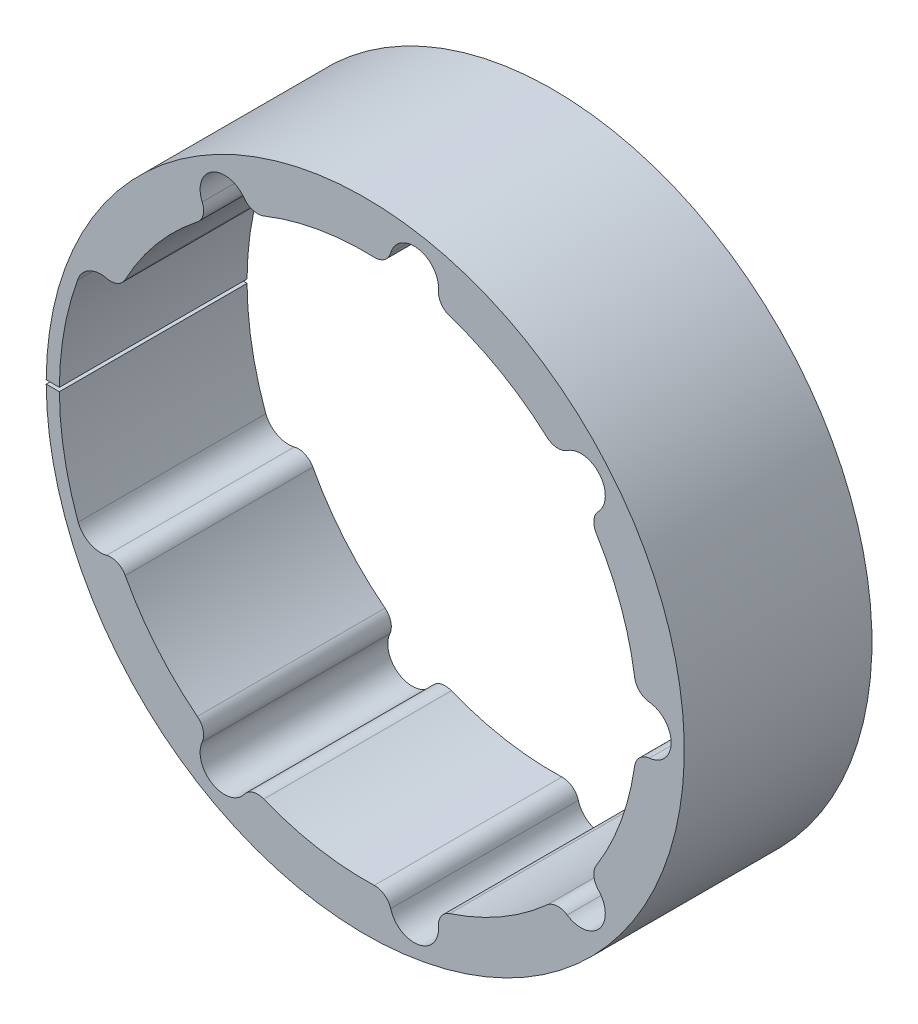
SolidWorks part; units mm, degrees
ref_plane "Front Plane" through (0, 0, 0) normal (0, 0, 1) x (1, 0, 0)
ref_plane "Top Plane" through (0, 0, 0) normal (0, 1, 0) x (1, 0, 0)
ref_plane "Right Plane" through (0, 0, 0) normal (1, 0, 0) x (0, 0, -1)
sketch "Sketch1" plane through (0, 0, 0) normal (0, 0, 1) x (1, 0, 0)
  line L0 (37.5, 3.25) -> (36.104, 3.25)
  line L1 (37.5, -3.25) -> (36.104, -3.25)
  line L2 (30.8157, -21.6149) -> (29.7463, -20.7176)
  line L3 (26.6376, -26.5942) -> (25.5682, -25.6969)
  line L4 (9.7124, -36.3659) -> (9.47, -34.9912)
  line L5 (3.3112, -37.4946) -> (3.0688, -36.1199)
  line L6 (-15.9354, -34.101) -> (-15.2374, -32.892)
  line L7 (-21.5646, -30.851) -> (-20.8666, -29.642)
  line L8 (-34.1269, -15.8798) -> (-32.8151, -15.4023)
  line L11 (-34.1269, 15.8798) -> (-32.8151, 15.4023)
  line L12 (-21.5646, 30.851) -> (-20.8666, 29.642)
  line L13 (-15.9354, 34.101) -> (-15.2374, 32.892)
  line L14 (3.3112, 37.4946) -> (3.0688, 36.1199)
  line L15 (9.7124, 36.3659) -> (9.47, 34.9912)
  line L16 (26.6376, 26.5942) -> (25.5682, 25.6969)
  line L17 (30.8157, 21.6149) -> (29.7463, 20.7176)
  line L18 (-38.4951, -10.5525) -> (-36.2195, -9.7242)
  line L19 (-36.8336, 9.9478) -> (-36.218, 9.7237)
  line L20 (0, 0) -> (-3.3956, 0)
  line L21 (-42.5, 0) -> (0, 0)
  line L23 (-42.4993, -0.25) -> (-40.747, -0.25)
  line L25 (-42.4993, 0.25) -> (-40.747, 0.25)
  line L26 (-40.747, -0.25) -> (-40.747, 0.25)
  line L27 (-44.253, -0.25) -> (-40.747, 0.25) construction
  line L28 (-44.253, 0.25) -> (-40.747, -0.25) construction
  arc A0 (36.104, 3.25) -> (29.7463, 20.7176) centre (0, 0) ccw
  arc A1 (37.5, -3.25) -> (37.5, 3.25) centre (37.5, 0) ccw
  circle A10 centre (0, 0) radius 37.5 construction
  arc A11 (26.6376, -26.5942) -> (30.8157, -21.6149) centre (28.7267, -24.1045) ccw
  arc A12 (3.3112, -37.4946) -> (9.7124, -36.3659) centre (6.5118, -36.9303) ccw
  arc A13 (-21.5646, -30.851) -> (-15.9354, -34.101) centre (-18.75, -32.476) ccw
  arc A14 (-38.2468, -14.0556) -> (-34.1269, -15.8798) centre (-35.2385, -12.8258) ccw
  arc A15 (-34.1269, 15.8798) -> (-38.3335, 13.8174) centre (-35.2385, 12.8258) ccw
  arc A16 (-15.9354, 34.101) -> (-21.5646, 30.851) centre (-18.75, 32.476) ccw
  arc A17 (9.7124, 36.3659) -> (3.3112, 37.4946) centre (6.5118, 36.9303) ccw
  arc A18 (30.8157, 21.6149) -> (26.6376, 26.5942) centre (28.7267, 24.1045) ccw
  arc A19 (25.5682, 25.6969) -> (9.47, 34.9912) centre (0, 0) ccw
  arc A20 (3.0688, 36.1199) -> (-15.2374, 32.892) centre (0, 0) ccw
  arc A21 (-20.8666, 29.642) -> (-32.8151, 15.4023) centre (0, 0) ccw
  arc A23 (-32.8151, -15.4023) -> (-20.8666, -29.642) centre (0, 0) ccw
  arc A24 (-15.2374, -32.892) -> (3.0688, -36.1199) centre (0, 0) ccw
  arc A25 (9.47, -34.9912) -> (25.5682, -25.6969) centre (0, 0) ccw
  arc A26 (29.7463, -20.7176) -> (36.104, -3.25) centre (0, 0) ccw
  circle A27 centre (0, 0) radius 42.5
  arc A28 (-38.3335, 13.8174) -> (-38.2468, -14.0556) centre (0, 0) ccw
  point P24 (0, 0)
  point P53 (0, 0)
  point P70 (0, 0)
  dimension "D1" = 72.5
  dimension "D2" = 6.5
  dimension "D4" = 75
  dimension "D5" = 85
  dimension "D3" = 9
  dimension "D6" = 0.5
extrude "Boss-Extrude1" add sketch "Sketch1" along normal blind 25 contours A28 A15 L11 A21 L12 A16 L13 A20 L14 A17 L15 A19 L16 A18 L17 A0 L0 A1 L1 A26 L2 A11 L3 A25 L4 A12 L5 A24 L6 A13 L7 A23 L8 A14 L23 A27 L25
fillet "Fillet1" radius 2.2 16 edges at (-32.8151, -15.4023, 12.5) (-20.8666, -29.642, 12.5) (-15.2374, -32.892, 12.5) (3.0688, -36.1199, 12.5) (9.47, -34.9912, 12.5) (25.5682, -25.6969, 12.5) (29.7463, -20.7176, 12.5) (36.104, -3.25, 12.5) (36.104, 3.25, 12.5) (29.7463, 20.7176, 12.5) (25.5682, 25.6969, 12.5) (9.47, 34.9912, 12.5) (3.0688, 36.1199, 12.5) (-15.2374, 32.892, 12.5) (-20.8666, 29.642, 12.5) (-32.8151, 15.4023, 12.5)
